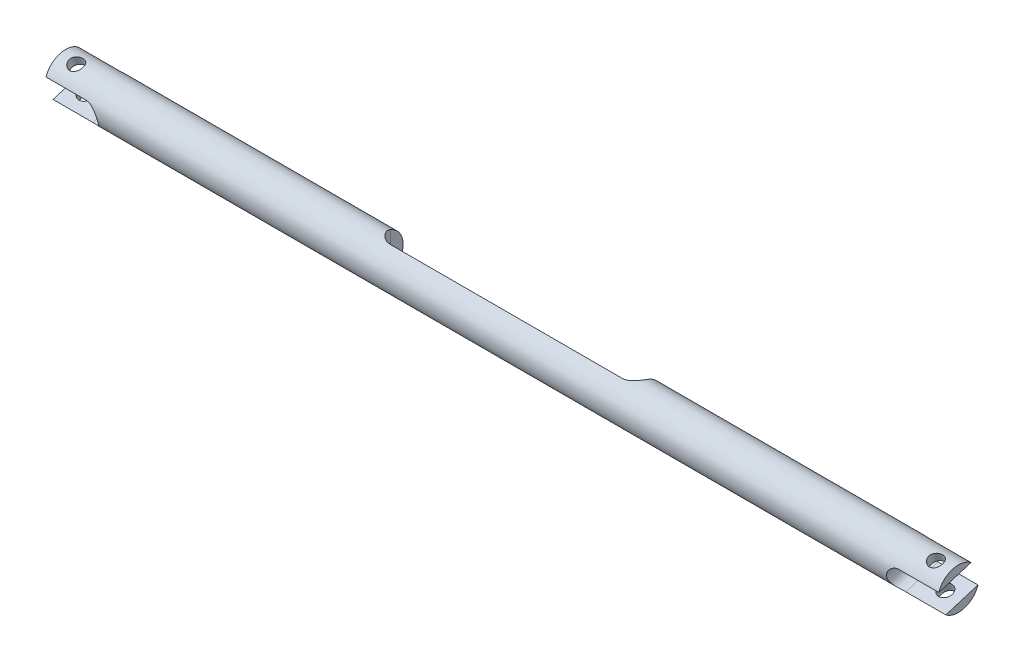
SolidWorks part; units mm, degrees
ref_plane "Front Plane" through (0, 0, 0) normal (0, 0, 1) x (1, 0, 0)
ref_plane "Top Plane" through (0, 0, 0) normal (0, 1, 0) x (1, 0, 0)
ref_plane "Right Plane" through (0, 0, 0) normal (1, 0, 0) x (0, 0, -1)
sketch "Sketch1" plane through (0, 0, 0) normal (1, 0, 0) x (0, 0, -1)
  circle A0 centre (0, 0) radius 9.525
  dimension "D1" = 19.05
extrude "Extrude1" add sketch "Sketch1" along normal mid plane 411.48
sketch "Sketch2" plane through (0, 0, 0) normal (0, 1, 0) x (1, 0, 0)
  line L1 (-59.69, 16.4033) -> (59.69, 16.4033)
  line L2 (-59.69, 16.4033) -> (-59.69, 3.7033)
  line L3 (-53.34, -2.6467) -> (53.34, -2.6467)
  line L4 (59.69, 16.4033) -> (59.69, 3.7033)
  arc A0 (-59.69, 3.7033) -> (-53.34, -2.6467) centre (-53.34, 3.7033) ccw
  arc A1 (59.69, 3.7033) -> (53.34, -2.6467) centre (53.34, 3.7033) cw
  dimension "D1" = 6.35
  dimension "D2" = 53.34
  dimension "D3" = 106.68
  dimension "D4" = 2.6467
  dimension "D5" = 19.05
extrude "RACK GEAR CUT" cut sketch "Sketch2" against normal through all and the other way through all
sketch "Sketch3" plane through (0, 0, 0) normal (0, 1, 0) x (1, 0, 0)
  line L0 (-198.12, 0) -> (198.12, 0) construction
  dimension "D1" = 396.24
  dimension "D2" = 198.12
ref_plane "Plane1" through (0, 0, 0) normal (0, -0.2924, 0.9563) x (1, 0, 0)
ref_plane "Plane2" through (0, 0, 0) normal (0, -0.9563, -0.2924) x (1, 0, 0)
sketch "Sketch5" plane through (0, 0, 0) normal (0, -0.9563, -0.2924) x (1, 0, 0)
  line L0 (0, 125.1508) -> (0, -95.473) construction
  line L1 (-198.12, 0) -> (198.12, 0) construction
  circle A0 centre (198.12, 0) radius 3.175
  circle A1 centre (-198.12, 0) radius 3.175
  dimension "D1" = 6.35
  dimension "D2" = 198.12
extrude "Cut-Extrude3" cut sketch "Sketch5" against normal through all and the other way through all
sketch "Sketch4" plane through (0, 0, 0) normal (0, 0.2924, -0.9563) x (1, 0, 0)
  line L0 (0, 103.7491) -> (0, -80.6729) construction
  line L1 (238.125, 5.5245) -> (187.325, 5.5245)
  line L2 (238.125, 5.5245) -> (238.125, -5.5245)
  line L3 (238.125, -5.5245) -> (187.325, -5.5245)
  line L4 (-238.125, -5.5245) -> (-187.325, -5.5245)
  line L5 (-198.12, 0) -> (198.12, 0) construction
  line L6 (-238.125, 5.5245) -> (-238.125, -5.5245)
  line L7 (-238.125, 5.5245) -> (-187.325, 5.5245)
  line L8 (198.6942, 5.5245) -> (198.6942, -5.5245) construction
  arc A0 (181.8005, 0) -> (187.325, 5.5245) centre (187.325, 0) cw
  arc A1 (181.8005, 0) -> (187.325, -5.5245) centre (187.325, 0) ccw
  arc A2 (-181.8005, 0) -> (-187.325, -5.5245) centre (-187.325, 0) cw
  arc A3 (-181.8005, 0) -> (-187.325, 5.5245) centre (-187.325, 0) ccw
  point P20 (198.6942, 0)
  dimension "D4" = 50.8
  dimension "D2" = 11.049
  dimension "D5" = 187.325
extrude "Cut-Extrude2" cut sketch "Sketch4" against normal through all and the other way through all
sketch "Sketch6" plane through (0, 0, 0) normal (0, 0.2924, -0.9563) x (1, 0, 0)
  line L0 (-205.74, 14.378) -> (-205.74, 7.9375)
  line L1 (-205.74, 9.525) -> (-205.74, 5.5245) construction
  line L2 (-205.74, 7.9375) -> (-187.325, 7.9375)
  line L3 (-205.74, 14.378) -> (-182.4306, 14.378)
  line L5 (-198.12, 0) -> (198.12, 0) construction
  arc A0 (-187.325, 7.9375) -> (-182.4306, 14.378) centre (-187.325, 13.0175) ccw
  dimension "D1" = 5.08
  dimension "D2" = 7.9375
extrude "Cut-Extrude4" [suppressed] cut sketch "Sketch6" against normal through all and the other way through all
mirror "Mirror3" [suppressed] about plane through (0, 0, 0) normal (0, -0.9563, -0.2924)
mirror "Mirror4" [suppressed] about plane through (0, 0, 0) normal (1, 0, 0)
